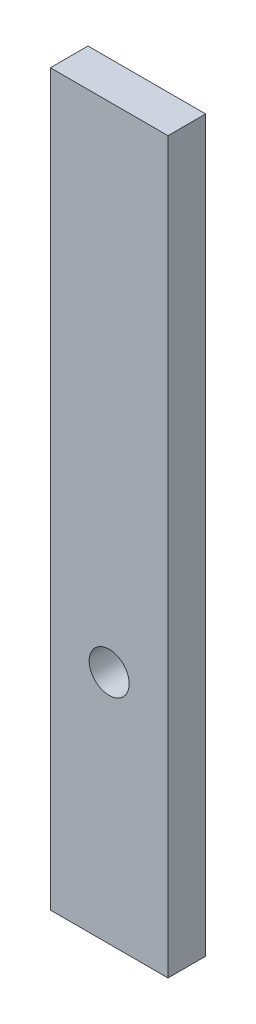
SolidWorks part; units mm, degrees
ref_plane "Plan de face" through (0, 0, 0) normal (0, 0, 1) x (1, 0, 0)
ref_plane "Plan de dessus" through (0, 0, 0) normal (0, 1, 0) x (1, 0, 0)
ref_plane "Plan de droite" through (0, 0, 0) normal (1, 0, 0) x (0, 0, -1)
sketch "Esquisse1" plane through (0, 0, 0) normal (0, 0, 1) x (1, 0, 0)
  line L1 (0, 0) -> (25, 0)
  line L2 (0, 0) -> (0, 155)
  line L3 (0, 155) -> (25, 155)
  line L4 (25, 0) -> (25, 155)
  dimension "D1" = 25
  dimension "D2" = 155
extrude "Extrusion1" add sketch "Esquisse1" along normal blind 8
hole_wizard "Trou taraudé M10x1.51" positions "Esquisse3" profile "Esquisse2" tap size "M10x1.5" standard "ISO"
sketch "Esquisse3" plane through (0, 0, 8) normal (0, 0, 1) x (1, 0, 0)
  line L0 (0, 0) -> (25, 0) construction
  line L1 (0, 155) -> (0, 0) construction
  point P0 (12.5, 50)
  dimension "D1" = 50
  dimension "D2" = 12.5
sketch "Esquisse2" plane through (12.5, 50, 8) normal (1, 0, 0) x (0, -1, 0)
  line L0 (0, 0) -> (0, 8)
  line L1 (0, 8) -> (4.25, 8)
  line L2 (4.25, 8) -> (4.25, 0)
  line L5 (4.25, 0) -> (0, 0)
  line L11 (0, -6.35) -> (0, 107.95) construction
  dimension "Diamètre du trou pour taraudage jusqu'au prochain" = 8.5
  dimension "Profondeur du trou pour taraudage jusqu'au prochain" = 8
